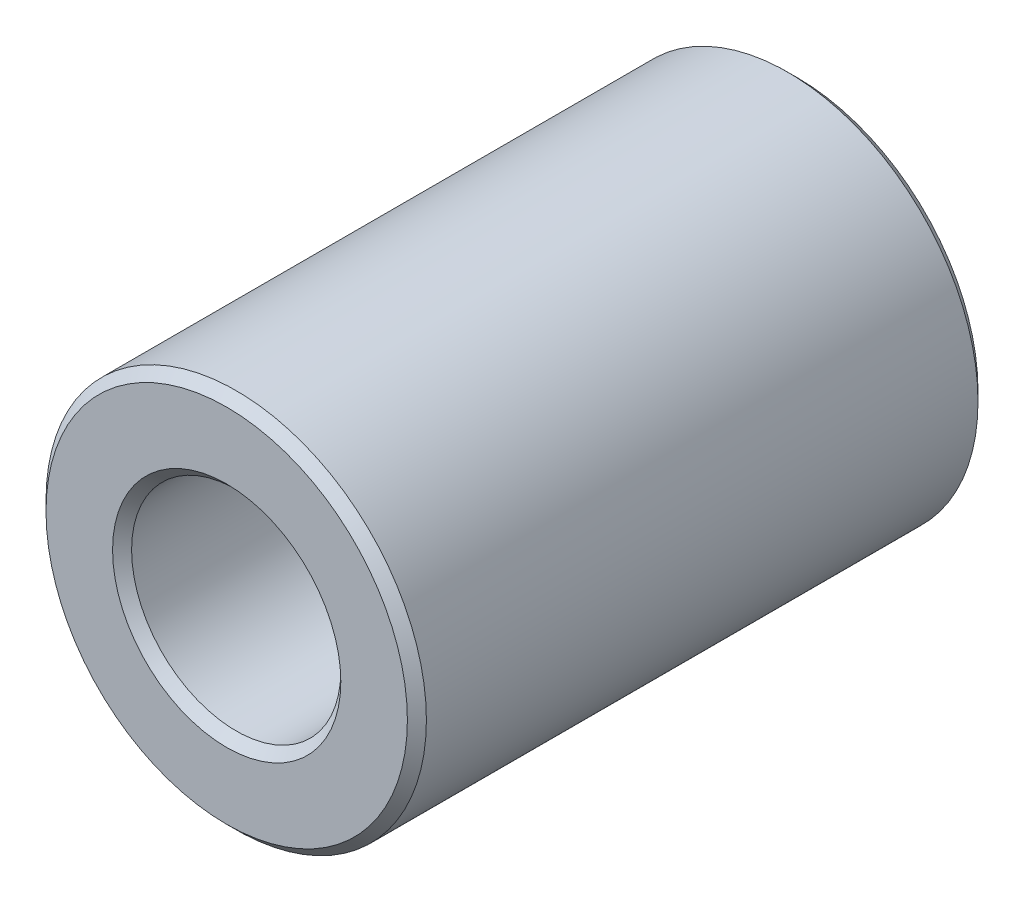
SolidWorks part; units mm, degrees
ref_plane "Front Plane" through (0, 0, 0) normal (0, 0, 1) x (1, 0, 0)
ref_plane "Top Plane" through (0, 0, 0) normal (0, 1, 0) x (1, 0, 0)
ref_plane "Right Plane" through (0, 0, 0) normal (1, 0, 0) x (0, 0, -1)
sketch "Sketch1" plane through (0, 0, 0) normal (0, 0, 1) x (1, 0, 0)
  circle A0 centre (0, 0) radius 2
  circle A1 centre (0, 0) radius 1.1
  dimension "D1" = 4
  dimension "D2" = 2.2
extrude "Boss-Extrude2" add sketch "Sketch1" along normal mid plane 6
chamfer "Chamfer3" distance 0.1 angle 45 4 edges at (2, 0, 3) (2, 0, -3) (1.1, 0, -3) (1.1, 0, 3)
